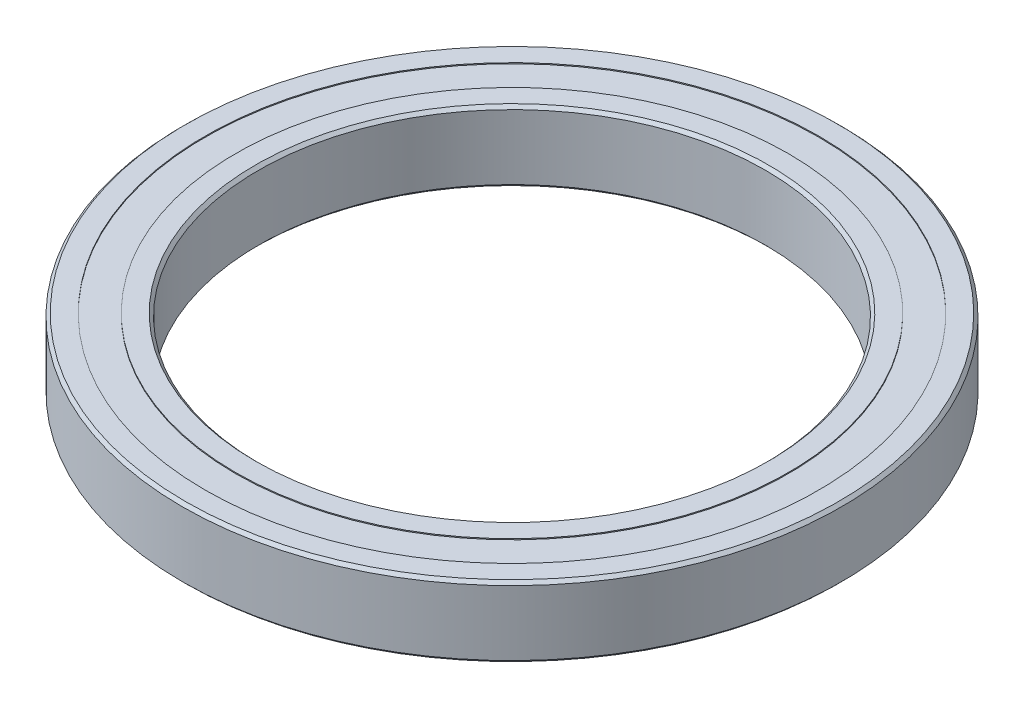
SolidWorks part; units mm, degrees
ref_plane "前视基准面" through (0, 0, 0) normal (0, 0, 1) x (1, 0, 0)
ref_plane "上视基准面" through (0, 0, 0) normal (0, 1, 0) x (1, 0, 0)
ref_plane "右视基准面" through (0, 0, 0) normal (1, 0, 0) x (0, 0, -1)
sketch "草图1" plane through (0, 0, 0) normal (0, 1, 0) x (1, 0, 0)
  circle A0 centre (0, 0) radius 25
  circle A1 centre (0, 0) radius 32.5
  dimension "D1" = 50
  dimension "D2" = 65
extrude "凸台-拉伸1" add sketch "草图1" along normal blind 7
chamfer "倒角1" distance 0.3 angle 45 4 edges at (0, 0, 25) (0, 0, 32.5) (0, 7, 25) (0, 7, 32.5)
sketch "草图2" plane through (0, 7, 0) normal (0, 1, 0) x (1, 0, 0)
  circle A0 centre (0, 0) radius 27.25
  circle A1 centre (0, 0) radius 30.25
  circle A2 centre (0, 0) radius 32.5 construction
  circle A3 centre (0, 0) radius 25 construction
  dimension "D1" = 2.25
  dimension "D2" = 2.25
extrude "切除-拉伸1" cut sketch "草图2" against normal blind 0.1
sketch "草图3" plane through (0, 0, 0) normal (0, -1, 0) x (1, 0, 0)
  circle A0 centre (0, 0) radius 27.25 construction
  circle A1 centre (0, 0) radius 30.25 construction
  circle A2 centre (0, 0) radius 27.25
  circle A3 centre (0, 0) radius 30.25
extrude "切除-拉伸2" cut sketch "草图3" against normal blind 0.1
